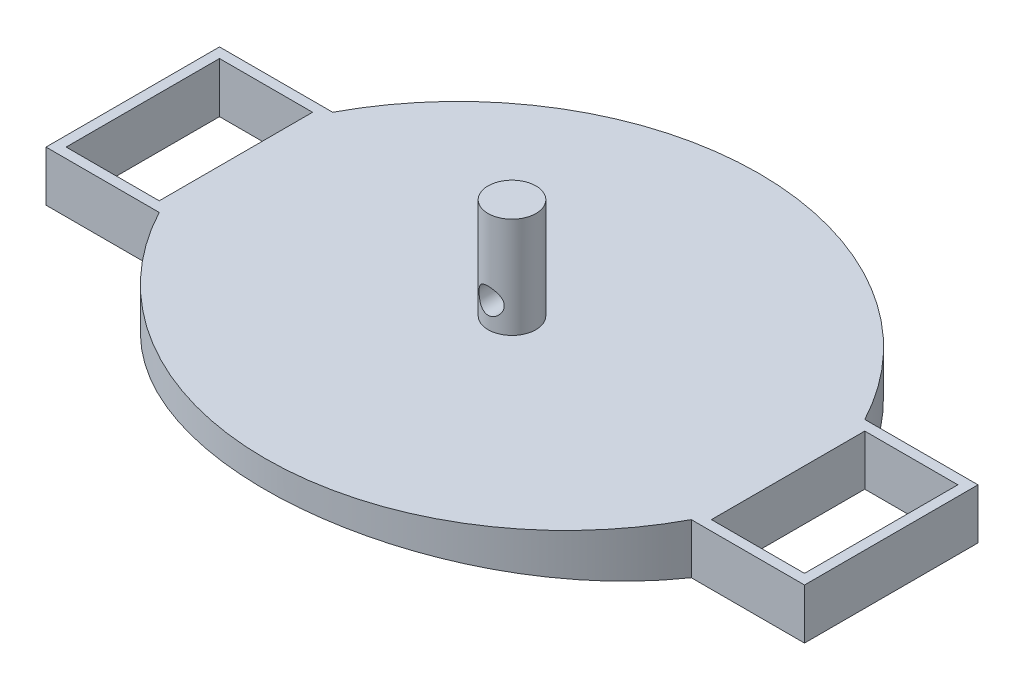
SolidWorks part; units mm, degrees
ref_plane "Front Plane" through (0, 0, 0) normal (0, 0, 1) x (1, 0, 0)
ref_plane "Top Plane" through (0, 0, 0) normal (0, 1, 0) x (1, 0, 0)
ref_plane "Right Plane" through (0, 0, 0) normal (1, 0, 0) x (0, 0, -1)
sketch "Sketch4" plane through (0, 0, 0) normal (0, 1, 0) x (1, 0, 0)
  line L1 (0, -55) -> (0, 55) construction
  line L3 (-52.8407, -44.8867) -> (52.8407, -44.8867) construction
  line L4 (0, 4.1584) -> (0, -93.9317) construction
  line L6 (52.8407, -62.1172) -> (75.3295, -62.1172)
  line L7 (52.8407, -27.6562) -> (75.3295, -27.6562)
  line L8 (75.3295, -62.1172) -> (75.3295, -27.6562)
  line L9 (-52.8407, -27.6562) -> (-75.3295, -27.6562)
  line L10 (-75.3295, -62.1172) -> (-75.3295, -27.6562)
  line L11 (-52.8407, -62.1172) -> (-75.3295, -62.1172)
  line L12 (-52.8407, -62.1172) -> (-52.8407, -27.6562) construction
  line L13 (54.8407, -60.1172) -> (54.8407, -29.6562)
  line L14 (-73.3295, -60.1172) -> (-54.8407, -60.1172)
  line L15 (-73.3295, -60.1172) -> (-73.3295, -29.6562)
  line L16 (-73.3295, -29.6562) -> (-54.8407, -29.6562)
  line L17 (-54.8407, -60.1172) -> (-54.8407, -29.6562)
  line L18 (73.3295, -29.6562) -> (54.8407, -29.6562)
  line L19 (73.3295, -60.1172) -> (73.3295, -29.6562)
  line L20 (73.3295, -60.1172) -> (54.8407, -60.1172)
  arc A1 (-52.8407, -62.1172) -> (52.8407, -62.1172) centre (0, -34.143) ccw
  arc A2 (-52.8407, -27.6562) -> (52.8407, -27.6562) centre (0, -55.6303) cw
  dimension "D2" = 34.461
  dimension "D3" = 2
  dimension "D1" = 2
  dimension "D4" = 2
  dimension "D5" = 22.4888
  dimension "D6" = 2
  dimension "D7" = 22.4888
extrude "Boss-Extrude3" add sketch "Sketch4" along normal blind 10
sketch "Sketch5" plane through (0, 10, 0) normal (0, 1, 0) x (1, 0, 0)
  line L0 (0, 4.1584) -> (0, -93.9317) construction
  line L1 (-52.8407, -44.8867) -> (52.8407, -44.8867) construction
  line L2 (-52.8407, -27.6562) -> (-52.8407, -62.1172) construction
  line L3 (52.8407, -62.1172) -> (52.8407, -27.6562) construction
  arc A0 (52.8407, -27.6562) -> (-52.8407, -27.6562) centre (0, -55.6303) ccw construction
  arc A1 (-52.8407, -62.1172) -> (52.8407, -62.1172) centre (0, -34.143) ccw construction
  circle A2 centre (0, -44.8867) radius 4.75
  dimension "D1" = 9.5
extrude "Boss-Extrude4" add sketch "Sketch5" along normal blind 20
ref_plane "Plane1" through (0, 0, 40.1367) normal (0, 0, -1) x (-1, 0, 0)
sketch "Sketch6" plane through (0, 0, 40.1367) normal (0, 0, -1) x (-1, 0, 0)
  line L0 (52.8407, 10) -> (-52.8407, 10) construction
  circle A0 centre (0, 15) radius 2.5
  dimension "D1" = 5
  dimension "D2" = 5
extrude "Cut-Extrude1" cut sketch "Sketch6" against normal up to next
ref_plane "Plane2" through (0, 0, 93.9317) normal (0, 0, 1) x (1, 0, 0)
sketch "Sketch7" plane through (0, 0, 93.9317) normal (0, 0, 1) x (1, 0, 0)
  line L0 (-52.8407, 0) -> (52.8407, 0)
  arc A0 (-52.8407, 0) -> (52.8407, 0) centre (0, -298.5918) cw
extrude "Cut-Extrude2" cut sketch "Sketch7" against normal up to next
